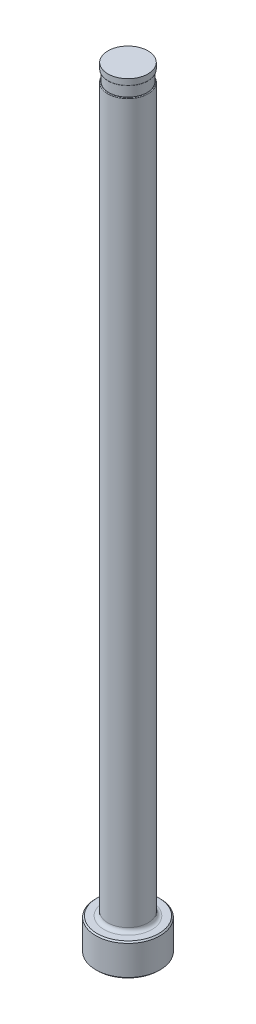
SolidWorks part; units mm, degrees
ref_plane "Front Plane" through (0, 0, 0) normal (0, 0, 1) x (1, 0, 0)
ref_plane "Top Plane" through (0, 0, 0) normal (0, 1, 0) x (1, 0, 0)
ref_plane "Right Plane" through (0, 0, 0) normal (1, 0, 0) x (0, 0, -1)
other "Configuration Table"
sketch "Sketch1" plane through (0, 0, 0) normal (0, 0, 1) x (1, 0, 0)
  line L0 (0, 259.9588) -> (0, -15.1925) construction
  line L1 (0, 0) -> (-6.35, 0)
  line L2 (-6.35, 0) -> (-6.35, 6.35)
  line L3 (-6.35, 6.35) -> (-3.9687, 6.35)
  line L4 (-3.9687, 6.35) -> (-3.9687, 152.4)
  line L5 (-3.9687, 152.4) -> (0, 152.4)
  line L6 (0, 152.4) -> (0, 0)
  dimension "L" = 152.4
  dimension "H" = 12.7
  dimension "T" = 6.35
  dimension "D" = 7.9375
revolve "Revolve1" add sketch "Sketch1" angle 360 about L0
chamfer "Chamfer1" distance 0.254 angle 45 2 edges at (0, 6.35, 6.35) (0, 0, 6.35)
fillet "Fillet1" radius 0.762 1 edges at (0, 6.35, 3.9687)
sketch "Sketch2" plane through (0, 0, 0) normal (0, 0, 1) x (1, 0, 0)
  line L0 (-3.9687, 152.4) -> (-3.9687, 7.112) construction
  line L1 (-3.9687, 151.13) -> (-3.7655, 151.13)
  line L2 (-3.9687, 151.13) -> (-3.9687, 149.098)
  line L3 (-3.9687, 149.098) -> (-3.7655, 149.098)
  line L4 (-3.7655, 151.13) -> (-3.7655, 149.098)
  line L5 (3.9687, 152.4) -> (-3.9687, 152.4) construction
  line L6 (0, 153.4483) -> (0, 147.3282) construction
  dimension "D1" = 2.032
  dimension "N" = 1.27
  dimension "FD" = 0.2032
  dimension "D3" = 7.5311
revolve "Vent Relief" cut sketch "Sketch2" angle 360 about L6
sketch "Sketch3" plane through (0, 0, 0) normal (0, 0, 1) x (1, 0, 0)
  line L0 (-3.7655, 150.114) -> (-3.7655, 86.614)
  line L1 (-3.7655, 151.13) -> (-3.7655, 149.098) construction
  line L2 (-3.9687, 149.098) -> (-3.9687, 7.112) construction
  line L3 (-3.9687, 85.4964) -> (-3.9687, 150.114)
  line L4 (-3.9687, 150.114) -> (-3.7655, 150.114)
  arc A0 (-3.7655, 86.614) -> (-3.9687, 85.4964) centre (-6.9405, 86.614) cw
  dimension "D1" = 3.175
  dimension "D2" = 63.5
extrude "D-Slot" cut sketch "Sketch3" against normal through all both and the other way through all
sketch "Sketch5" plane through (0, 0, 0) normal (0, 0, 1) x (1, 0, 0)
  line L0 (-3.9687, 151.13) -> (3.9687, 151.13) construction
  line L1 (-3.9687, 152.4) -> (-3.956, 152.4)
  line L2 (-3.9687, 152.4) -> (-3.9687, 151.13)
  line L3 (-3.9687, 151.13) -> (-3.956, 151.13)
  line L4 (-3.956, 152.4) -> (-3.956, 151.13)
  line L5 (0, 152.6877) -> (0, 150.5771) construction
  dimension "VP" = 0.0127
revolve "Vent Diameter" cut sketch "Sketch5" angle 360 about L5
fillet "Fillet2" radius 0.127 2 edges at (3.9687, 149.098, 0) (0, 151.13, 3.956)
sketch "Pocket Sketch" plane through (0, 0, 0) normal (0, 0, 1) x (1, 0, 0)
  line L0 (-6.7469, 0) -> (-6.7469, 6.3754)
  line L1 (-6.7469, 6.3754) -> (-4.9292, 6.3754)
  line L2 (-4.1672, 7.1374) -> (-4.1672, 22.225)
  line L3 (-4.1672, 22.225) -> (0, 22.225)
  line L4 (0, 22.225) -> (0, 0)
  line L5 (0, 0) -> (-6.7469, 0)
  line L6 (0, 12.6104) -> (0, -2.4989) construction
  line L7 (-6.35, 6.096) -> (-6.35, 0.254) construction
  line L8 (6.096, 6.35) -> (-6.096, 6.35) construction
  line L9 (-3.9687, 85.4964) -> (-3.9687, 7.112) construction
  line L10 (-4.9292, 6.3754) -> (-4.1672, 7.1374)
  point P3 (-4.1672, 6.3754)
  dimension "D1" = 13.4937
  dimension "D2" = 0.3969
  dimension "D3" = 0.0254
  dimension "D4" = 0.1984
  dimension "D5" = 8.3344
  dimension "D6" = 22.225
